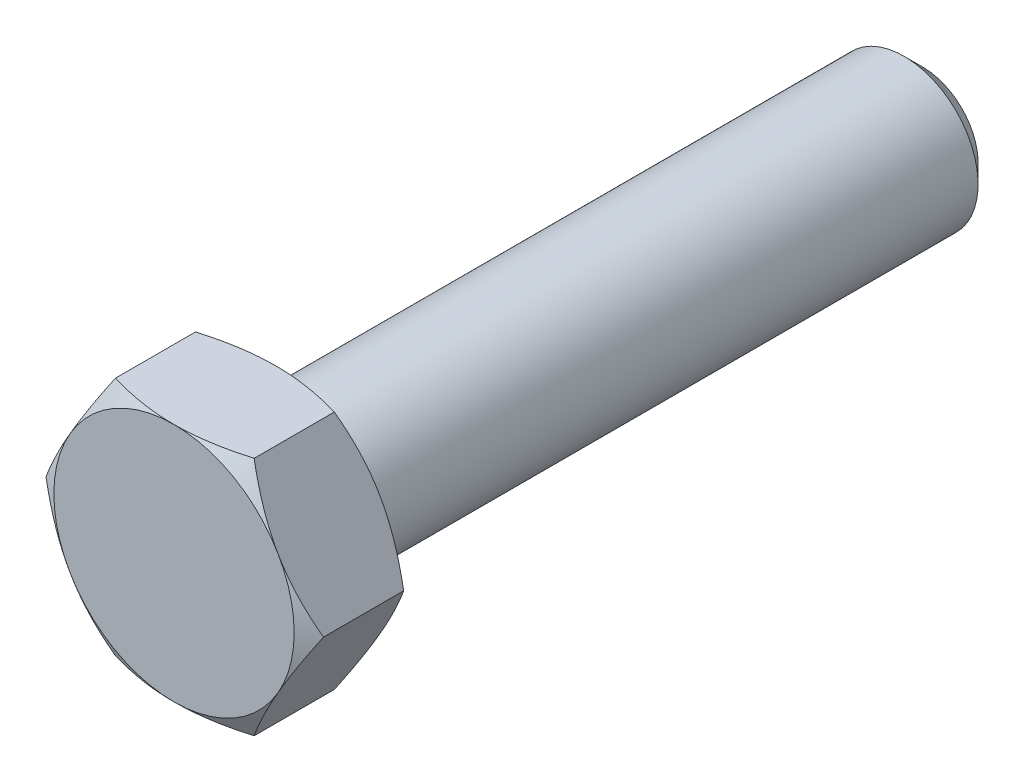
SolidWorks part; units mm, degrees
ref_plane "Plan1" through (0, 0, 0) normal (0, 0, 1) x (1, 0, 0)
ref_plane "Plan2" through (0, 0, 0) normal (0, 1, 0) x (1, 0, 0)
ref_plane "Plan3" through (0, 0, 0) normal (1, 0, 0) x (0, 0, -1)
sketch "Esquisse1" plane through (0, 0, 0) normal (0, 0, 1) x (1, 0, 0)
  line L0 (-3.7528, -6.5) -> (-7.5056, 0)
  line L1 (3.7528, -6.5) -> (-3.7528, -6.5)
  line L2 (7.5056, 0) -> (3.7528, -6.5)
  line L3 (-7.5056, 0) -> (-3.7528, 6.5)
  line L4 (-3.7528, 6.5) -> (3.7528, 6.5)
  line L5 (3.7528, 6.5) -> (7.5056, 0)
  dimension "D1" = 6.5
  dimension "D2" = 6.5
  dimension "D3" = 6.5
  dimension "D4" = 6.5
  dimension "D5" = 6.5
extrude "Base-Extrusion" add sketch "Esquisse1" along normal blind 5.5
sketch "Esquisse2" plane through (0, 0, 0) normal (0, 0, -1) x (-1, 0, 0)
  line L0 (3.7528, 6.5) -> (-3.7528, 6.5) construction
  circle A0 centre (0, 0) radius 8.952
  circle A1 centre (0, 0) radius 6.5
extrude "Enlèv. mat.-Extru.1" cut sketch "Esquisse2" against normal blind 5 draft 60
sketch "Esquisse3" plane through (0, 0, 5.5) normal (0, 0, 1) x (1, 0, 0)
  line L0 (-3.7528, 6.5) -> (3.7528, 6.5) construction
  circle A0 centre (0, 0) radius 6.5
  circle A1 centre (0, 0) radius 9.1193
extrude "Enlèv. mat.-Extru.2" cut sketch "Esquisse3" against normal blind 5 draft 60
sketch "Esquisse4" plane through (0, 0, 0) normal (0, 0, -1) x (-1, 0, 0)
  circle A0 centre (0, 0) radius 4
  dimension "D1" = 8
extrude "Boss.-Extru.1" add sketch "Esquisse4" along normal blind 35
chamfer "Chanfrein1" distance 1 angle 45
